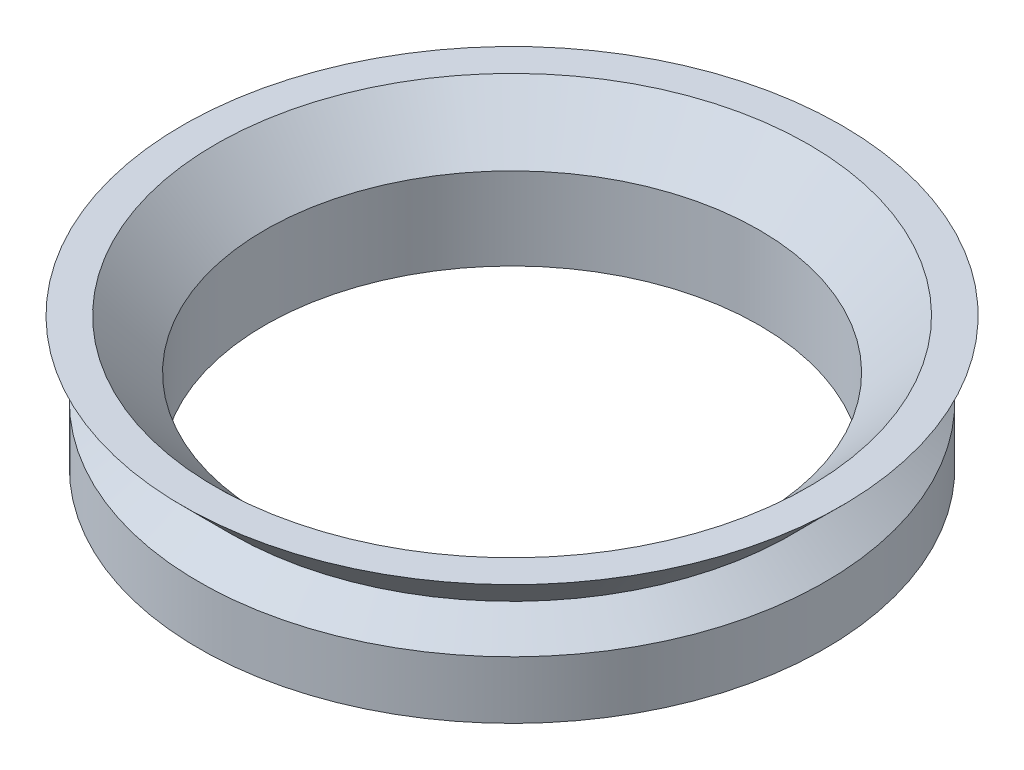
SolidWorks part; units mm, degrees
ref_plane "Face" through (0, 0, 0) normal (0, 0, 1) x (1, 0, 0)
ref_plane "Dessus" through (0, 0, 0) normal (0, 1, 0) x (1, 0, 0)
ref_plane "Droite" through (0, 0, 0) normal (1, 0, 0) x (0, 0, -1)
sketch "Esquisse1" plane through (0, 0, 0) normal (0, 0, 1) x (1, 0, 0)
  line L0 (0, -24.2489) -> (0, 43.958) construction
  line L1 (15, 5) -> (15, 0)
  line L2 (15, 0) -> (19, 0)
  line L3 (19, 0) -> (19, 3.5)
  line L4 (19, 3.5) -> (17, 5)
  line L5 (17, 5) -> (20, 8)
  line L6 (20, 8) -> (18, 8)
  line L7 (18, 8) -> (15, 5)
  dimension "D1" = 30
  dimension "D2" = 38
  dimension "D3" = 8
  dimension "D4" = 40
  dimension "D5" = 2
  dimension "D6" = 5
  dimension "D7" = 3.5
revolve "Révolution1" add sketch "Esquisse1" angle 360 about L0
